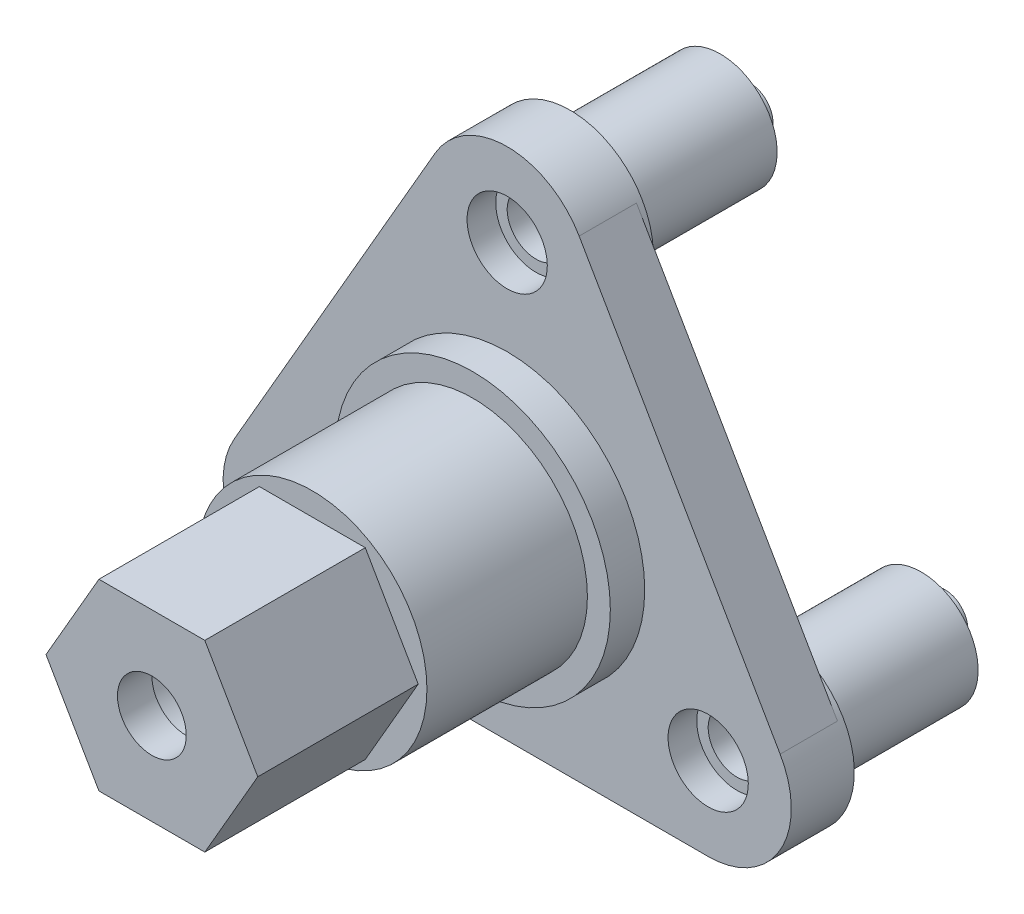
SolidWorks part; units mm, degrees
ref_plane "Plan1" through (0, 0, 0) normal (0, 0, 1) x (1, 0, 0)
ref_plane "Plan2" through (0, 0, 0) normal (0, 1, 0) x (1, 0, 0)
ref_plane "Plan3" through (0, 0, 0) normal (1, 0, 0) x (0, 0, -1)
sketch "Esquisse2" plane through (0, 0, 0) normal (0, 0, 1) x (1, 0, 0)
  circle A0 centre (0, 0) radius 12
  circle A1 centre (0, 0) radius 3
  dimension "D1" = 24
  dimension "D2" = 6
extrude "rondin 28 percé 6" add sketch "Esquisse2" along normal blind 31
sketch "Esquisse3" plane through (0, 0, 31) normal (0, 0, 1) x (1, 0, 0)
  circle A0 centre (0, 0) radius 10
  dimension "D1" = 20
extrude "chariotage 20" cut sketch "Esquisse3" against normal blind 28 flip side to cut
sketch "Esquisse5" plane through (0, 0, 31) normal (0, 0, 1) x (1, 0, 0)
  line L6 (0, 0) -> (0, -11.9956) construction
  line L7 (-4.6188, -8) -> (4.6188, -8)
  line L8 (-9.2376, 0) -> (-4.6188, -8)
  line L9 (-4.6188, 8) -> (-9.2376, 0)
  line L10 (4.6188, 8) -> (-4.6188, 8)
  line L11 (9.2376, 0) -> (4.6188, 8)
  line L12 (4.6188, -8) -> (9.2376, 0)
  dimension "D1" = 8
  dimension "D2" = 16
  dimension "D3" = 16
  dimension "D4" = 8
  dimension "D5" = 120
  dimension "D6" = 120
  dimension "D7" = 8
  dimension "D8" = 120
  dimension "D9" = 8
extrude "hexagone" cut sketch "Esquisse5" against normal blind 14 flip side to cut
sketch "Esquisse6" plane through (0, 0, 0) normal (0, 0, -1) x (-1, 0, 0)
  circle A0 centre (0, 0) radius 4.05
  dimension "D1" = 8.1
extrude "alésage 8" cut sketch "Esquisse6" against normal blind 28
sketch "Esquisse7" plane through (0, 0, 0) normal (0, 0, -1) x (-1, 0, 0)
  line L0 (-17.537, -17.375) -> (17.537, -17.375)
  line L1 (0, 0) -> (0, -54.2148) construction
  line L2 (-6.2787, 23.875) -> (-23.8157, -6.5)
  line L3 (23.8157, -6.5) -> (6.2787, 23.875)
  line L4 (0, 0) -> (15.0472, 8.6875) construction
  line L5 (6.3606, -16.5777) -> (32.6567, -1.3956) construction
  line L6 (17.537, -4.6263) -> (17.537, -22.0077) construction
  arc A1 (17.537, -17.375) -> (23.8157, -6.5) centre (17.537, -10.125) ccw
  arc A3 (-6.2787, 23.875) -> (6.2787, 23.875) centre (0, 20.25) cw
  arc A4 (-17.537, -17.375) -> (-23.8157, -6.5) centre (-17.537, -10.125) cw
  point P6 (0, -27.1074)
  dimension "D2" = 20.25
  dimension "D3" = 20.25
  dimension "D4" = 7.25
  dimension "D5" = 7.25
  dimension "D6" = 60
  dimension "D1" = 20.25
  dimension "D7" = 60
extrude "embase triangulaire" add sketch "Esquisse7" along normal blind 5
sketch "Esquisse13" plane through (0, 0, 0) normal (0, 0, 1) x (1, 0, 0)
  circle A1 centre (0, 0) radius 4.05
  circle A2 centre (0, 0) radius 4.05
  dimension "D1" = 0
extrude "Enlèv. mat.-Extru.1" cut sketch "Esquisse13" against normal blind 10
sketch "Esquisse14" plane through (0, 0, -5) normal (0, 0, -1) x (-1, 0, 0)
  circle A0 centre (0, 0) radius 10.5
  circle A1 centre (0, 0) radius 4.05 construction
  dimension "D1" = 21
extrude "lamage 21" cut sketch "Esquisse14" against normal blind 1
sketch "Esquisse8" plane through (0, 0, -5) normal (0, 0, -1) x (-1, 0, 0)
  circle A0 centre (17.537, -10.125) radius 4.95
  arc A1 (17.537, -17.375) -> (23.8157, -6.5) centre (17.537, -10.125) ccw construction
  dimension "D1" = 9.9
extrude "tourillon de 10" add sketch "Esquisse8" along normal blind 13.6
sketch "Esquisse12" plane through (0, 0, -5) normal (0, 0, -1) x (-1, 0, 0)
  circle A0 centre (17.537, -10.125) radius 7.25
  arc A1 (17.537, -17.375) -> (23.8157, -6.5) centre (17.537, -10.125) ccw construction
extrude "bossage de 0.5" add sketch "Esquisse12" along normal blind 0.5
sketch "Esquisse9" plane through (0, 0, -18.6) normal (0, 0, -1) x (-1, 0, 0)
  circle A0 centre (17.189, -9.8146) radius 2
  dimension "D1" = 4
extrude "téton de 4" add sketch "Esquisse9" along normal blind 2.5
sketch "Esquisse10" plane through (0, 0, 0) normal (0, 0, 1) x (1, 0, 0)
  circle A0 centre (-17.537, -10.125) radius 3.5
  dimension "D1" = 7
extrude "lamage de 7" cut sketch "Esquisse10" against normal blind 2.5
sketch "Esquisse11" plane through (0, 0, 0) normal (0, 0, 1) x (1, 0, 0)
  circle A0 centre (-17.537, -10.125) radius 2.5
  dimension "D1" = 5
extrude "forage de 4" cut sketch "Esquisse11" against normal blind 11
pattern_circular "Répétition circulaire1" count 3 every 120
